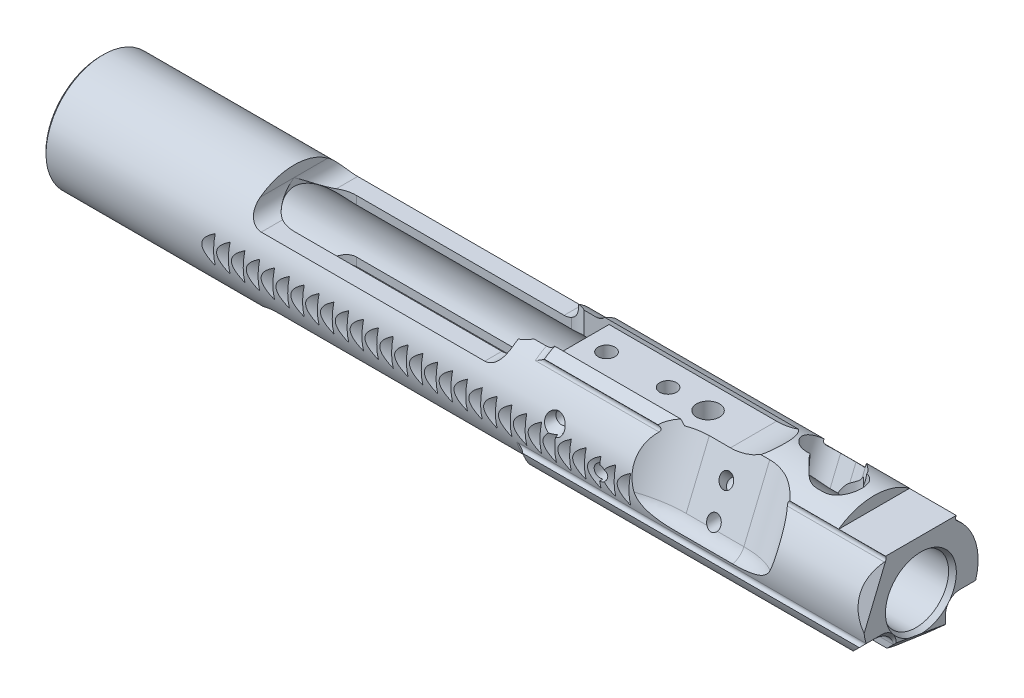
SolidWorks part; units mm, degrees
ref_plane "Front Plane" through (0, 0, 0) normal (0, 0, 1) x (1, 0, 0)
ref_plane "Top Plane" through (0, 0, 0) normal (0, 1, 0) x (1, 0, 0)
ref_plane "Right Plane" through (0, 0, 0) normal (1, 0, 0) x (0, 0, -1)
sketch "Sketch1" plane through (0, 0, 0) normal (1, 0, 0) x (0, 0, -1)
  circle A0 centre (0, 0) radius 11.7983
  dimension "D1" = 23.5966
extrude "Boss-Extrude1" add sketch "Sketch1" against normal blind 169.164
sketch "Sketch2" plane through (-169.164, 0, 0) normal (-1, 0, 0) x (0, 0, 1)
  circle A0 centre (0, 0) radius 7.9375
  dimension "D1" = 15.875
extrude "Cut-Extrude1" cut sketch "Sketch2" against normal blind 97.917
fillet "Fillet1" radius 1.5875 1 edges at (-71.247, 0, 7.9375)
sketch "Sketch3" plane through (0, 0, 0) normal (0, 0, 1) x (1, 0, 0)
  line L0 (-80.01, 6.35) -> (-126.111, 6.35)
  line L1 (-129.286, 9.525) -> (-129.286, 11.7983)
  line L2 (0, 11.7983) -> (-169.164, 11.7983) construction
  line L3 (-129.286, 11.7983) -> (-76.835, 11.7983)
  line L4 (-76.835, 11.7983) -> (-76.835, 9.525)
  line L5 (-169.164, 11.7983) -> (-169.164, -11.7983) construction
  line L6 (-169.164, -11.7983) -> (0, -11.7983) construction
  line L7 (-122.3462, -6.35) -> (-71.298, -6.35)
  line L8 (-71.298, -6.35) -> (-71.298, -11.7983)
  line L9 (-71.298, -11.7983) -> (-129.286, -11.7983)
  arc A0 (-126.111, 6.35) -> (-129.286, 9.525) centre (-126.111, 9.525) cw
  arc A1 (-80.01, 6.35) -> (-76.835, 9.525) centre (-80.01, 9.525) ccw
  arc A2 (-122.3462, -6.35) -> (-129.286, -11.7983) centre (-122.3462, -13.494) ccw
  dimension "D4" = 3.175
  dimension "D7" = 14.288
  dimension "D1" = 6.35
  dimension "D2" = 39.878
  dimension "D3" = 52.451
  dimension "D6" = 6.35
  dimension "D8" = 97.866
extrude "Cut-Extrude2" cut sketch "Sketch3" against normal mid plane 30
sketch "Sketch4" plane through (0, 6.35, 0) normal (0, 1, 0) x (1, 0, 0)
  line L0 (-136.4041, 0) -> (-71.6825, 0) construction
  line L1 (-129.286, -6.9623) -> (-129.286, 6.9623) construction
  line L3 (-122.8545, 6.4315) -> (-78.473, 6.4315)
  line L4 (-122.8545, -6.4315) -> (-78.473, -6.4315)
  line L5 (-169.164, 11.7983) -> (-169.164, -11.7983) construction
  arc A0 (-122.8545, 6.4315) -> (-122.8545, -6.4315) centre (-122.8545, 0) ccw
  arc A1 (-78.473, -6.4315) -> (-78.473, 6.4315) centre (-78.473, 0) ccw
  dimension "D1" = 12.863
  dimension "D2" = 12.863
  dimension "D3" = 90.691
extrude "Cut-Extrude3" cut sketch "Sketch4" against normal up to next and the other way up to next
sketch "Sketch5" plane through (0, -6.35, 0) normal (0, -1, 0) x (1, 0, 0)
  line L0 (-169.164, 0) -> (-116.3804, 0) construction
  line L1 (-169.164, 11.7983) -> (-169.164, -11.7983) construction
  line L2 (-129.286, 0) -> (-129.286, 4.226) construction
  line L3 (-122.8545, 6.4315) -> (-78.1436, 6.4315)
  line L4 (-78.1436, 6.4315) -> (-78.1436, -6.4315)
  line L5 (-78.1436, -6.4315) -> (-122.8545, -6.4315)
  arc A0 (-122.8545, 6.4315) -> (-122.8545, -6.4315) centre (-122.8545, 0) ccw
  spline S0 degree 3 poles (-122.3462, 9.9437) (-122.9959, 9.9437) (-123.6281, 9.8897) (-124.5504, 9.718) (-124.8481, 9.646) (-125.4159, 9.4721) (-125.6874, 9.3698) (-126.2059, 9.1303) (-126.4505, 8.9936) (-126.9004, 8.6908) (-127.1077, 8.5238) (-127.4897, 8.1561) (-127.6639, 7.9553) (-127.9739, 7.5305) (-128.1113, 7.3052) (-128.3563, 6.8285) (-128.4643, 6.5758) (-128.6514, 6.0562) (-128.7312, 5.7883) (-128.8695, 5.2369) (-128.9279, 4.9535) (-129.0282, 4.3715) (-129.0701, 4.0716) (-129.1752, 3.1611) (-129.2184, 2.5411) (-129.274, 1.2768) (-129.2861, 0.6287) (-129.2859, -0.6503) (-129.2737, -1.2858) (-129.2318, -2.233) (-129.2137, -2.5489) (-129.1671, -3.1727) (-129.1387, -3.4788) (-129.0343, -4.3794) (-128.9395, -4.9566) (-128.7322, -5.7849) (-128.6515, -6.056) (-128.4633, -6.5786) (-128.3566, -6.8279) (-128.1128, -7.3025) (-127.9758, -7.5278) (-127.665, -7.9541) (-127.4902, -8.1555) (-126.9207, -8.7042) (-126.4769, -9.004) (-125.4341, -9.4879) (-124.8667, -9.6584) (-123.9464, -9.8308) (-123.6295, -9.8735) (-122.9934, -9.9297) (-122.6716, -9.9437) (-122.3462, -9.9437) knots 0 0 0 0 0.0625 0.0625 0.09375 0.09375 0.125 0.125 0.15625 0.15625 0.1875 0.1875 0.21875 0.21875 0.25 0.25 0.28125 0.28125 0.3125 0.3125 0.34375 0.34375 0.375 0.375 0.4375 0.4375 0.5 0.5 0.5625 0.5625 0.59375 0.59375 0.625 0.625 0.6875 0.6875 0.71875 0.71875 0.75 0.75 0.78125 0.78125 0.8125 0.8125 0.875 0.875 0.9375 0.9375 0.96875 0.96875 1 1 1 1 construction
  dimension "D2" = 12.863
extrude "Cut-Extrude4" cut sketch "Sketch5" against normal up to next and the other way up to next
sketch "Sketch6" plane through (-169.164, 0, 0) normal (-1, 0, 0) x (0, 0, 1)
  line L0 (0, 0) -> (0, -11.7983) construction
  line L1 (-1.9939, -8.8159) -> (1.9939, -8.8159)
  line L2 (-1.9939, -8.8159) -> (-1.9939, -10.9859)
  line L3 (-1.9939, -13.3258) -> (1.9939, -13.3258)
  line L4 (1.9939, -10.9859) -> (1.9939, -8.8159)
  line L5 (-1.9939, -10.9859) -> (-2.9111, -11.9031)
  line L6 (-2.9111, -11.9031) -> (-2.9111, -13.3258)
  line L7 (-2.9111, -13.3258) -> (-1.9939, -13.3258)
  line L8 (1.9939, -10.9859) -> (2.9111, -11.9031)
  line L9 (2.9111, -11.9031) -> (2.9111, -13.3258)
  line L10 (2.9111, -13.3258) -> (1.9939, -13.3258)
  circle A0 centre (0, 0) radius 11.7983 construction
  point P9 (0, -8.8159)
  dimension "D1" = 8.8159
  dimension "D2" = 3.9878
  dimension "D3" = 2.17
extrude "Cut-Extrude5" cut sketch "Sketch6" against normal up to next
chamfer "Chamfer1" distance 0.508 1 edges at (-169.164, 11.7983, 0)
sketch "Sketch9" plane through (0, 0, 0) normal (0, 0, 1) x (1, 0, 0)
  line L0 (0, 0) -> (-71.247, 0) construction
  line L1 (-71.247, 6.35) -> (-71.247, -6.35) construction
  line L2 (-1.016, 6.731) -> (-29.845, 6.731)
  line L3 (-1.016, 6.731) -> (0, 7.3176)
  line L4 (0, -11.7983) -> (0, 11.7983) construction
  line L5 (-30.5049, 6.35) -> (-42.634, 6.35)
  line L6 (-30.5049, 6.35) -> (-29.845, 6.731)
  line L7 (-45.174, 6.35) -> (-46.863, 6.35)
  line L8 (-46.863, 6.35) -> (-46.863, 3.1877)
  line L9 (-46.863, 3.1877) -> (-49.6062, 3.1877)
  line L10 (-49.6062, 3.1877) -> (-49.6062, 3.7465)
  line L11 (-49.6062, 3.7465) -> (-57.4, 3.7465)
  line L12 (-57.4, 3.7465) -> (-57.4, 5.588)
  line L13 (-57.4, 5.588) -> (-71.247, 5.588)
  line L14 (-71.247, 5.588) -> (-71.247, 0)
  line L15 (0, 7.3176) -> (0, 0)
  line L16 (0, 0) -> (-71.247, 0)
  arc A0 (-42.634, 6.35) -> (-45.174, 6.35) centre (-43.904, 6.35) ccw
  dimension "D8" = 2.54
  dimension "D9" = 2.959
  dimension "D1" = 13.462
  dimension "D2" = 30
  dimension "D3" = 1.016
  dimension "D4" = 29.845
  dimension "D5" = 12.7
  dimension "D6" = 30
  dimension "D7" = 46.863
  dimension "D10" = 6.3754
  dimension "D11" = 2.7432
  dimension "D12" = 7.493
  dimension "D13" = 57.4
  dimension "D14" = 11.176
revolve "Cut-Revolve1" cut sketch "Sketch9" angle 360 about L0
sketch "Sketch12" plane through (0, 0, 0) normal (1, 0, 0) x (0, 0, -1)
  line L0 (0, 0) -> (0, 12.5603) construction
  line L1 (0, 0) -> (-7.9164, 9.7515) construction
  line L2 (0, 0) -> (-12.0179, -3.6513) construction
  arc A1 (-11.7743, -4.3733) -> (11.7743, -4.3733) centre (0, 0) ccw
  arc A2 (-11.2888, -3.4298) -> (11.2888, -3.4298) centre (0, 0) ccw
  arc A3 (-7.4361, 9.1599) -> (-7.3105, 10.2136) centre (-7.9164, 9.7515) ccw
  arc A4 (-11.7743, -4.3733) -> (-11.2888, -3.4298) centre (-12.0179, -3.6513) ccw
  circle A5 centre (0, 0) radius 11.7983 construction
  arc A6 (11.7743, -4.3733) -> (11.2888, -3.4298) centre (12.0179, -3.6513) cw
  arc A7 (7.4361, 9.1599) -> (7.3105, 10.2136) centre (7.9164, 9.7515) cw
  arc A8 (7.3105, 10.2136) -> (-7.3105, 10.2136) centre (0, 0) ccw
  arc A9 (7.4361, 9.1599) -> (-7.4361, 9.1599) centre (0, 0) ccw
  dimension "D3" = 1.524
  dimension "D4" = 12.5603
  dimension "D1" = 39.07
  dimension "D2" = 106.9
extrude "Boss-Extrude2" add sketch "Sketch12" against normal blind 72.0921
sketch "Sketch13" plane through (0, 0, 0) normal (0, 0, 1) x (1, 0, 0)
  line L0 (0, 12.5603) -> (-70.358, 12.5603) construction
  line L1 (0, 12.5603) -> (-72.0921, 12.5603) construction
  line L3 (-129.286, 11.7983) -> (-72.0921, 11.7983) construction
  line L4 (0, 0) -> (-62.44, 0) construction
  line L6 (-129.286, 9.525) -> (-129.286, 11.7983) construction
  circle A0 centre (-72.0921, 14.1525) radius 2.3542
  dimension "D1" = 70.358
revolve "Cut-Revolve2" cut sketch "Sketch13" angle 360 about L4
sketch "Sketch10" plane through (0, 0, 0) normal (0, 0, 1) x (1, 0, 0)
  line L0 (-34.925, 10.617) -> (-69.4692, 10.617)
  line L1 (-75.782, 17.653) -> (-47.625, 23.317)
  arc A0 (-75.782, 17.653) -> (-69.4692, 10.617) centre (-75.782, 11.303) ccw
  arc A1 (-34.925, 10.617) -> (-47.625, 23.317) centre (-34.925, 23.317) ccw
  dimension "D1" = 12.7
  dimension "D4" = 25.4
  dimension "D2" = 75.782
  dimension "D3" = 11.303
  dimension "D5" = 23.317
  dimension "D6" = 34.925
extrude "Cut-Extrude8" cut sketch "Sketch10" against normal mid plane 10.3124
sketch "Sketch14" plane through (0, 0, 0) normal (1, 0, 0) x (0, 0, -1)
  line L0 (-7.29, 10.1854) -> (7.29, 10.1854)
  arc A0 (7.3105, 10.2136) -> (-7.3105, 10.2136) centre (0, 0) ccw construction
  arc A1 (7.3105, 10.2136) -> (-7.3105, 10.2136) centre (0, 0) ccw
  arc A2 (-7.4361, 9.1599) -> (-7.3105, 10.2136) centre (-7.9164, 9.7515) ccw construction
  arc A3 (-7.29, 10.1854) -> (-7.3105, 10.2136) centre (-7.9164, 9.7515) ccw
  arc A4 (7.3105, 10.2136) -> (7.4361, 9.1599) centre (7.9164, 9.7515) ccw construction
  arc A5 (7.3105, 10.2136) -> (7.29, 10.1854) centre (7.9164, 9.7515) ccw
  dimension "D1" = 10.1854
extrude "Cut-Extrude9" cut sketch "Sketch14" against normal blind 9.652
sketch "Sketch15" plane through (0, 0, 0) normal (1, 0, 0) x (0, 0, -1)
  line L0 (0, 0) -> (0, -12.5603) construction
  line L1 (0, 0) -> (-7.0649, -6.9865) construction
  line L2 (-8.1505, -5.3252) -> (-10.5149, -6.8701)
  line L3 (2.858, -9.246) -> (-2.858, -9.246)
  line L4 (-5.0804, -6.9865) -> (-5.0804, -8.3254)
  line L5 (-5.0804, -8.3254) -> (-2.858, -9.246)
  line L6 (5.0804, -8.3254) -> (2.858, -9.246)
  line L7 (5.0804, -6.9865) -> (5.0804, -8.3254)
  line L8 (8.1505, -5.3252) -> (10.5149, -6.8701)
  arc A0 (-11.7743, -4.3733) -> (11.7743, -4.3733) centre (0, 0) ccw construction
  arc A1 (-5.0804, -6.9865) -> (-8.1505, -5.3252) centre (-7.0649, -6.9865) ccw
  arc A2 (-10.5149, -6.8701) -> (10.5149, -6.8701) centre (0, 0) ccw
  arc A3 (5.0804, -6.9865) -> (8.1505, -5.3252) centre (7.0649, -6.9865) cw
  point P15 (0, -9.246)
  dimension "D3" = 3.969
  dimension "D1" = 45.32
  dimension "D2" = 9.936
  dimension "D4" = 5.0804
  dimension "D5" = 2.858
  dimension "D6" = 22.5
  dimension "D7" = 9.246
extrude "Cut-Extrude10" cut sketch "Sketch15" against normal blind 71.2978
sketch "Sketch17" plane through (0, 0, 0) normal (1, 0, 0) x (0, 0, -1)
  line L0 (-2.2866, -6.35) -> (-9.9437, -6.35) construction
  line L1 (9.9437, -6.35) -> (2.2866, -6.35) construction
  line L3 (-5.0804, -8.3254) -> (-5.0804, -6.9865) construction
  line L4 (-2.858, -9.246) -> (-5.0804, -8.3254) construction
  line L5 (2.858, -9.246) -> (-2.858, -9.246) construction
  line L6 (5.0804, -8.3254) -> (2.858, -9.246) construction
  line L7 (5.0804, -6.9865) -> (5.0804, -8.3254) construction
  line L9 (-5.1853, -6.35) -> (-9.7188, -6.35)
  line L10 (9.7188, -6.35) -> (5.1853, -6.35)
  line L12 (-5.0804, -8.3254) -> (-5.0804, -6.9865)
  line L13 (-2.858, -9.246) -> (-5.0804, -8.3254)
  line L14 (2.858, -9.246) -> (-2.858, -9.246)
  line L15 (5.0804, -8.3254) -> (2.858, -9.246)
  line L16 (5.0804, -6.9865) -> (5.0804, -8.3254)
  line L17 (-8.1505, -5.3252) -> (-10.5149, -6.8701) construction
  line L18 (-9.7188, -6.35) -> (-9.9925, -6.5288)
  line L19 (9.9925, -6.5288) -> (8.1505, -5.3252) construction
  line L20 (9.9925, -6.5288) -> (9.7188, -6.35)
  arc A0 (-5.0804, -6.9865) -> (-8.1505, -5.3252) centre (-7.0649, -6.9865) ccw construction
  arc A1 (8.1505, -5.3252) -> (5.0804, -6.9865) centre (7.0649, -6.9865) ccw construction
  arc A2 (-9.9925, -6.5288) -> (9.9925, -6.5288) centre (0, 0) ccw construction
  arc A3 (-5.0804, -6.9865) -> (-5.1853, -6.35) centre (-7.0649, -6.9865) ccw
  arc A4 (5.1853, -6.35) -> (5.0804, -6.9865) centre (7.0649, -6.9865) ccw
  arc A5 (-9.9925, -6.5288) -> (9.9925, -6.5288) centre (0, 0) ccw
extrude "Cut-Extrude11" cut sketch "Sketch17" against normal blind 81.2978
sketch "Sketch18" plane through (-71.2978, 0, 0) normal (1, 0, 0) x (0, 0, -1)
  line L2 (5.1853, -6.35) -> (9.7188, -6.35)
  line L3 (9.7188, -6.35) -> (8.1505, -5.3252)
  line L4 (5.1853, -6.35) -> (9.7188, -6.35)
  line L5 (9.7188, -6.35) -> (8.1505, -5.3252)
  arc A3 (8.1505, -5.3252) -> (5.1853, -6.35) centre (7.0649, -6.9865) ccw
  arc A5 (8.1505, -5.3252) -> (5.1853, -6.35) centre (7.0649, -6.9865) ccw
  dimension "D1" = 0
ref_plane "Plane1" through (0, 0, -7.0649) normal (0, 0, 1) x (1, 0, 0)
sketch "Sketch19" plane through (0, 0, -7.0649) normal (0, 0, 1) x (1, 0, 0)
  line L0 (-71.2978, -49.6068) -> (-71.2978, -5.002) construction
  line L1 (-71.2978, -49.6068) -> (-94.0311, -11.2298) construction
  arc A0 (-71.2978, -5.002) -> (-94.0311, -11.2298) centre (-71.2978, -49.6068) ccw
  dimension "D1" = 89.2097
sweep "Cut-Sweep1" cut profiles "Sketch18" path "Sketch19"
mirror "Mirror1" about plane through (0, 0, 0) normal (0, 0, 1) of "Cut-Sweep1"
sketch "Sketch20" plane through (0, 0, 0) normal (0, 0, 1) x (1, 0, 0)
  line L0 (-72.0921, -6.35) -> (-122.3462, -6.35) construction
  line L1 (-71.298, -9.246) -> (-73.2608, -9.246)
  line L2 (-71.298, -9.246) -> (-71.298, -6.35)
  line L3 (-71.298, -6.35) -> (-73.2608, -6.35)
  line L4 (-73.2608, -9.246) -> (-73.2608, -6.35)
extrude "Cut-Extrude12" cut sketch "Sketch20" against normal up to next and the other way up to next
sketch "Sketch22" plane through (0, 0, 0) normal (0, 1, 0) x (1, 0, 0)
  line L0 (-118.1731, 0) -> (-60.3792, 0) construction
  line L1 (-71.247, 5.588) -> (-71.247, -5.588) construction
  line L2 (-71.247, 5.583) -> (-71.247, -5.583)
  line L3 (-78.4735, -6.4315) -> (-73.0446, -7.1565)
  line L4 (-78.1436, -6.4315) -> (-81.7584, -6.4315) construction
  line L5 (-78.4735, -6.4315) -> (-78.4735, 6.4315)
  line L6 (-78.4735, 6.4315) -> (-73.0446, 7.1565)
  arc A0 (-73.0446, -7.1565) -> (-71.247, -5.583) centre (-72.8345, -5.583) ccw
  arc A1 (-73.0446, 7.1565) -> (-71.247, 5.583) centre (-72.8345, 5.583) cw
  point P13 (-71.247, 0)
  point P17 (-78.4735, 0)
  dimension "D1" = 3.175
  dimension "D2" = 5.583
  dimension "D3" = 5.639
extrude "Cut-Extrude13" cut sketch "Sketch22" against normal up to surface (6.35 mm away)
sketch "Sketch24" plane through (0, 0, 0) normal (0, 0, 1) x (1, 0, 0)
  line L0 (-43.307, -9.246) -> (-71.298, -8.3254)
  line L1 (-71.298, -8.3254) -> (-71.298, -9.246)
  line L2 (-71.298, -9.246) -> (-43.307, -9.246)
  line L3 (-71.298, -9.246) -> (0, -9.246) construction
  line L4 (-71.298, -8.3254) -> (-71.298, -6.9865) construction
  dimension "D2" = 43.307
extrude "Cut-Extrude15" cut sketch "Sketch24" against normal up to next and the other way up to next
sketch "Sketch25" plane through (0, 0, 0) normal (1, 0, 0) x (0, 0, -1)
  line L0 (-11.2887, -3.43) -> (11.2887, -3.43) construction
  arc A0 (-7.4361, 9.1599) -> (-11.2888, -3.4298) centre (0, 0) ccw construction
  arc A1 (11.2888, -3.4298) -> (7.4361, 9.1599) centre (0, 0) ccw construction
  dimension "D1" = 3.43
ref_plane "Plane2" through (-1.715, -1.715, 0) normal (0.7071, 0.7071, 0) x (-0.7071, 0.7071, 0)
sketch "Sketch27" plane through (-1.715, -1.715, 0) normal (0.7071, 0.7071, 0) x (-0.7071, 0.7071, 0)
  line L0 (-2.4254, 11.2887) -> (-2.4254, -11.2887) construction
  line L1 (-4.9402, -5.0804) -> (-5.887, -5.0804) construction
  line L2 (-4.5319, -5.0804) -> (-5.7795, -5.0804)
  line L3 (-2.4254, -8.059) -> (-2.4254, -11.7743)
  line L4 (46.6582, -11.7743) -> (-3.0924, -11.7743) construction
  line L5 (-2.4254, -11.7743) -> (-6.6384, -11.7743)
  line L6 (-6.6384, -11.7743) -> (-6.6384, -5.0804)
  line L7 (0, 0) -> (-14.9346, 0) construction
  line L8 (-2.4254, 11.7743) -> (-6.6384, 11.7743)
  line L9 (-2.4254, 8.059) -> (-2.4254, 11.7743)
  line L11 (-6.6384, 11.7743) -> (-6.6384, 5.0804)
  line L12 (-4.5319, 5.0804) -> (-5.7795, -5.0804)
  line L13 (-6.6384, 5.0804) -> (-6.6384, -5.0804)
  ellipse E0 centre (-4.5319, -8.059) end of major axis (-4.5319, -5.0804) minor radius 2.1065 (-2.4254, -8.059) -> (-4.5319, -5.0804) ccw
  ellipse E1 centre (-4.5319, 8.059) end of major axis (-4.5319, 5.0804) minor radius 2.1065 (-2.4254, 8.059) -> (-4.5319, 5.0804) cw
  dimension "D1" = 8.059
  dimension "D2" = 4.213
  dimension "D3" = 7
extrude "Cut-Extrude17" cut sketch "Sketch27" against normal blind 8.3566
sketch "Sketch28" plane through (0, 0, 0) normal (1, 0, 0) x (0, 0, -1)
  line L0 (0, 0) -> (0, 9.2596) construction
  line L1 (-12.197, -2.5741) -> (-7.2124, 9.4599)
  arc A0 (-7.4361, 9.1599) -> (-7.29, 10.1854) centre (-7.9164, 9.7515) ccw construction
  dimension "D1" = 22.5
ref_plane "Plane3" through (0, 9.4599, 0) normal (0, 1, 0) x (-1, 0, 0)
sketch "Sketch31" plane through (0, 9.4599, 0) normal (0, 1, 0) x (-1, 0, 0)
  line L0 (0, 7.2124) -> (5, 12.2124)
  line L1 (5, 12.2124) -> (0, 12.2124)
  line L2 (0, 12.2124) -> (0, 7.2124)
  dimension "D1" = 45
  dimension "D2" = 5
sweep "Cut-Sweep2" cut profiles "Sketch31" path "Sketch28"
ref_plane "Plane4" through (-27.388, 0, 0) normal (1, 0, 0) x (0, 0, -1)
sketch "Sketch32" plane through (-27.388, 0, 0) normal (1, 0, 0) x (0, 0, -1)
  line L0 (-9.1211, -0.891) -> (-3.7922, 11.9742)
  line L1 (0, 0) -> (0, 9.0623) construction
  line L2 (-9.1211, -0.891) -> (-14.1082, 1.1747) construction
  line L3 (-12.0544, 0.324) -> (-13.2694, -2.6093) construction
  arc A0 (-13.2694, -2.6093) -> (-9.1211, -0.891) centre (-12.0544, 0.324) ccw
  arc A1 (7.3105, 10.2136) -> (-7.3105, 10.2136) centre (0, 0) ccw construction
  arc A2 (7.3105, 10.2136) -> (-7.3105, 10.2136) centre (0, 0) ccw construction
  dimension "D4" = 6.35
  dimension "D1" = 22.5
  dimension "D2" = 9.1211
  dimension "D3" = 0.891
ref_plane "Plane5" through (-27.388, 11.9742, 3.7922) normal (0, 0.9239, -0.3827) x (-1, 0, 0)
sketch "Sketch33" plane through (-27.388, 11.9742, 3.7922) normal (0, 0.9239, -0.3827) x (-1, 0, 0)
  line L0 (0, 0) -> (11.899, 0)
  line L1 (-8.9803, 3.7197) -> (20.8793, 3.7197)
  arc A0 (-8.9803, 3.7197) -> (0, 0) centre (0, 12.7) ccw
  arc A1 (11.899, 0) -> (20.8793, 3.7197) centre (11.899, 12.7) ccw
  dimension "D1" = 25.4
  dimension "D2" = 25.4
  dimension "D3" = 11.899
sweep "Cut-Sweep4" cut profiles "Sketch33" path "Sketch32"
fillet "Fillet2" radius 2 1 edges at (-71.298, -8.3254, 0)
sketch "Sketch34" plane through (0, 10.617, 0) normal (0, 1, 0) x (1, 0, 0)
  line L0 (0, 0) -> (-69.4692, 0) construction
  line L1 (-69.4692, 5.1562) -> (-69.4692, -5.1562) construction
  circle A0 centre (-43.9039, 0) radius 2.3749
  dimension "D1" = 4.7498
  dimension "D2" = 43.9039
extrude "Cut-Extrude18" cut sketch "Sketch34" against normal up to next
ref_plane "Plane6" through (-64.2747, 0, 0) normal (1, 0, 0) x (0, 0, -1)
sketch "Sketch35" plane through (-64.2747, 0, 0) normal (1, 0, 0) x (0, 0, -1)
  line L0 (0, 0) -> (0, 10.617) construction
  line L2 (-11.8825, 3.9692) -> (11.8825, 3.9692) construction
  line L3 (5.1562, 10.617) -> (-5.1562, 10.617) construction
  line L4 (-9.7907, 5.2011) -> (0, 5.2011)
  line L5 (-9.7907, 5.2011) -> (-11.8825, 6.4088)
  line L6 (-11.8825, 3.9692) -> (-11.8825, 6.4088)
  line L7 (0, 5.2011) -> (6.6656, 5.2011)
  line L8 (6.6656, 5.2011) -> (10.7351, 7.5506)
  line L9 (11.8825, 7.5506) -> (11.8825, 3.9692)
  line L10 (10.7351, 7.5506) -> (11.8825, 7.5506)
  line L11 (11.8825, 3.9692) -> (-11.8825, 3.9692)
  point P10 (0, 3.9692)
  dimension "D1" = 6.6478
  dimension "D2" = 2.4638
  dimension "D3" = 9.7907
  dimension "D4" = 30
  dimension "D5" = 30
  dimension "D6" = 6.6656
  dimension "D7" = 7.1628
revolve "Cut-Revolve3" cut sketch "Sketch35" angle 360 about L11
sketch "Sketch36" plane through (0, 0, 0) normal (0, 0, 1) x (1, 0, 0)
  circle A0 centre (-54.5211, 0) radius 1.4351
  circle A1 centre (-33.9344, 0) radius 1.397
  dimension "D1" = 2.8702
  dimension "D2" = 54.5211
  dimension "D3" = 2.794
  dimension "D4" = 33.9344
extrude "Cut-Extrude19" cut sketch "Sketch36" along normal up to next
ref_plane "Plane7" through (-33.9344, 0, 0) normal (1, 0, 0) x (0, 0, -1)
sketch "Sketch37" plane through (-33.9344, 0, 0) normal (1, 0, 0) x (0, 0, -1)
  line L0 (0, 0) -> (-8.0365, 0) construction
  line L1 (0, 0) -> (-7.7756, 7.7756) construction
  line L2 (-7.7756, 7.7756) -> (-6.7878, 8.7634)
  line L3 (-6.7878, 8.7634) -> (-2.0988, 4.0744)
  line L4 (-2.0988, 4.0744) -> (-3.0866, 3.0866)
  line L5 (-7.7756, 7.7756) -> (-3.0866, 3.0866)
  dimension "D1" = 45
  dimension "D2" = 2.794
revolve "Cut-Revolve4" cut sketch "Sketch37" angle 360 about L1
sketch "Sketch38" plane through (0, 0, 0) normal (0, 1, 0) x (1, 0, 0)
  line L0 (0, 0) -> (-126.9169, 0) construction
  line L1 (-136.5261, -18.8523) -> (-134.0988, -18.8523)
  line L2 (0, -18.8523) -> (-162.5946, -18.8523) construction
  line L3 (-136.5261, -18.8523) -> (-136.5261, -11.7983)
  line L4 (-134.0988, -18.8523) -> (-134.0988, -10.9148)
  line L5 (-134.0988, -10.9148) -> (-136.5261, -11.7983)
  line L6 (-133.4661, -18.8523) -> (-133.4661, -11.7983)
  line L7 (-131.0388, -10.9148) -> (-133.4661, -11.7983)
  line L8 (-131.0388, -18.8523) -> (-131.0388, -10.9148)
  line L9 (-133.4661, -18.8523) -> (-131.0388, -18.8523)
  line L10 (-130.4061, -18.8523) -> (-130.4061, -11.7983)
  line L11 (-127.9788, -10.9148) -> (-130.4061, -11.7983)
  line L12 (-127.9788, -18.8523) -> (-127.9788, -10.9148)
  line L13 (-130.4061, -18.8523) -> (-127.9788, -18.8523)
  line L14 (-127.3461, -18.8523) -> (-127.3461, -11.7983)
  line L15 (-124.9188, -10.9148) -> (-127.3461, -11.7983)
  line L16 (-124.9188, -18.8523) -> (-124.9188, -10.9148)
  line L17 (-127.3461, -18.8523) -> (-124.9188, -18.8523)
  line L18 (-124.2861, -18.8523) -> (-124.2861, -11.7983)
  line L19 (-121.8588, -10.9148) -> (-124.2861, -11.7983)
  line L20 (-121.8588, -18.8523) -> (-121.8588, -10.9148)
  line L21 (-124.2861, -18.8523) -> (-121.8588, -18.8523)
  line L22 (-121.2261, -18.8523) -> (-121.2261, -11.7983)
  line L23 (-118.7988, -10.9148) -> (-121.2261, -11.7983)
  line L24 (-118.7988, -18.8523) -> (-118.7988, -10.9148)
  line L25 (-121.2261, -18.8523) -> (-118.7988, -18.8523)
  line L26 (-118.1661, -18.8523) -> (-118.1661, -11.7983)
  line L27 (-115.7388, -10.9148) -> (-118.1661, -11.7983)
  line L28 (-115.7388, -18.8523) -> (-115.7388, -10.9148)
  line L29 (-118.1661, -18.8523) -> (-115.7388, -18.8523)
  line L30 (-115.1061, -18.8523) -> (-115.1061, -11.7983)
  line L31 (-112.6788, -10.9148) -> (-115.1061, -11.7983)
  line L32 (-112.6788, -18.8523) -> (-112.6788, -10.9148)
  line L33 (-115.1061, -18.8523) -> (-112.6788, -18.8523)
  line L34 (-112.0461, -18.8523) -> (-112.0461, -11.7983)
  line L35 (-109.6188, -10.9148) -> (-112.0461, -11.7983)
  line L36 (-109.6188, -18.8523) -> (-109.6188, -10.9148)
  line L37 (-112.0461, -18.8523) -> (-109.6188, -18.8523)
  line L38 (-108.9861, -18.8523) -> (-108.9861, -11.7983)
  line L39 (-106.5588, -10.9148) -> (-108.9861, -11.7983)
  line L40 (-106.5588, -18.8523) -> (-106.5588, -10.9148)
  line L41 (-108.9861, -18.8523) -> (-106.5588, -18.8523)
  line L42 (-105.9261, -18.8523) -> (-105.9261, -11.7983)
  line L43 (-103.4988, -10.9148) -> (-105.9261, -11.7983)
  line L44 (-103.4988, -18.8523) -> (-103.4988, -10.9148)
  line L45 (-105.9261, -18.8523) -> (-103.4988, -18.8523)
  line L46 (-102.8661, -18.8523) -> (-102.8661, -11.7983)
  line L47 (-100.4388, -10.9148) -> (-102.8661, -11.7983)
  line L48 (-100.4388, -18.8523) -> (-100.4388, -10.9148)
  line L49 (-102.8661, -18.8523) -> (-100.4388, -18.8523)
  line L50 (-99.8061, -18.8523) -> (-99.8061, -11.7983)
  line L51 (-97.3788, -10.9148) -> (-99.8061, -11.7983)
  line L52 (-97.3788, -18.8523) -> (-97.3788, -10.9148)
  line L53 (-99.8061, -18.8523) -> (-97.3788, -18.8523)
  line L54 (-96.7461, -18.8523) -> (-96.7461, -11.7983)
  line L55 (-94.3188, -10.9148) -> (-96.7461, -11.7983)
  line L56 (-94.3188, -18.8523) -> (-94.3188, -10.9148)
  line L57 (-96.7461, -18.8523) -> (-94.3188, -18.8523)
  line L58 (-93.6861, -18.8523) -> (-93.6861, -11.7983)
  line L59 (-91.2588, -10.9148) -> (-93.6861, -11.7983)
  line L60 (-91.2588, -18.8523) -> (-91.2588, -10.9148)
  line L61 (-93.6861, -18.8523) -> (-91.2588, -18.8523)
  line L62 (-90.6261, -18.8523) -> (-90.6261, -11.7983)
  line L63 (-88.1988, -10.9148) -> (-90.6261, -11.7983)
  line L64 (-88.1988, -18.8523) -> (-88.1988, -10.9148)
  line L65 (-90.6261, -18.8523) -> (-88.1988, -18.8523)
  line L66 (-87.5661, -18.8523) -> (-87.5661, -11.7983)
  line L67 (-85.1388, -10.9148) -> (-87.5661, -11.7983)
  line L68 (-85.1388, -18.8523) -> (-85.1388, -10.9148)
  line L69 (-87.5661, -18.8523) -> (-85.1388, -18.8523)
  line L70 (-84.5061, -18.8523) -> (-84.5061, -11.7983)
  line L71 (-82.0788, -10.9148) -> (-84.5061, -11.7983)
  line L72 (-82.0788, -18.8523) -> (-82.0788, -10.9148)
  line L73 (-84.5061, -18.8523) -> (-82.0788, -18.8523)
  line L74 (-81.4461, -18.8523) -> (-81.4461, -11.7983)
  line L75 (-79.0188, -10.9148) -> (-81.4461, -11.7983)
  line L76 (-79.0188, -18.8523) -> (-79.0188, -10.9148)
  line L77 (-81.4461, -18.8523) -> (-79.0188, -18.8523)
  line L78 (-78.3861, -18.8523) -> (-78.3861, -11.7983)
  line L79 (-75.9588, -10.9148) -> (-78.3861, -11.7983)
  line L80 (-75.9588, -18.8523) -> (-75.9588, -10.9148)
  line L81 (-78.3861, -18.8523) -> (-75.9588, -18.8523)
  line L82 (-75.3261, -18.8523) -> (-75.3261, -11.7983)
  line L83 (-72.8988, -10.9148) -> (-75.3261, -11.7983)
  line L84 (-72.8988, -18.8523) -> (-72.8988, -10.9148)
  line L85 (-75.3261, -18.8523) -> (-72.8988, -18.8523)
  line L86 (-72.2661, -18.8523) -> (-72.2661, -11.7983)
  line L87 (-69.8388, -10.9148) -> (-72.2661, -11.7983)
  line L88 (-69.8388, -18.8523) -> (-69.8388, -10.9148)
  line L89 (-72.2661, -18.8523) -> (-69.8388, -18.8523)
  line L90 (-69.2061, -18.8523) -> (-69.2061, -11.7983)
  line L91 (-66.7788, -10.9148) -> (-69.2061, -11.7983)
  line L92 (-66.7788, -18.8523) -> (-66.7788, -10.9148)
  line L93 (-69.2061, -18.8523) -> (-66.7788, -18.8523)
  line L94 (-66.1461, -18.8523) -> (-66.1461, -11.7983)
  line L95 (-63.7188, -10.9148) -> (-66.1461, -11.7983)
  line L96 (-63.7188, -18.8523) -> (-63.7188, -10.9148)
  line L97 (-66.1461, -18.8523) -> (-63.7188, -18.8523)
  line L98 (-63.0861, -18.8523) -> (-63.0861, -11.7983)
  line L99 (-60.6588, -10.9148) -> (-63.0861, -11.7983)
  line L100 (-60.6588, -18.8523) -> (-60.6588, -10.9148)
  line L101 (-63.0861, -18.8523) -> (-60.6588, -18.8523)
  line L102 (-60.0261, -18.8523) -> (-60.0261, -11.7983)
  line L103 (-57.5988, -10.9148) -> (-60.0261, -11.7983)
  line L104 (-57.5988, -18.8523) -> (-57.5988, -10.9148)
  line L105 (-60.0261, -18.8523) -> (-57.5988, -18.8523)
  line L106 (-56.9661, -18.8523) -> (-56.9661, -11.7983)
  line L107 (-54.5388, -10.9148) -> (-56.9661, -11.7983)
  line L108 (-54.5388, -18.8523) -> (-54.5388, -10.9148)
  line L109 (-56.9661, -18.8523) -> (-54.5388, -18.8523)
  line L110 (-53.9061, -18.8523) -> (-53.9061, -11.7983)
  line L111 (-51.4788, -10.9148) -> (-53.9061, -11.7983)
  line L112 (-51.4788, -18.8523) -> (-51.4788, -10.9148)
  line L113 (-53.9061, -18.8523) -> (-51.4788, -18.8523)
  line L114 (-50.8461, -18.8523) -> (-50.8461, -11.7983)
  line L115 (-48.4188, -10.9148) -> (-50.8461, -11.7983)
  line L116 (-48.4188, -18.8523) -> (-48.4188, -10.9148)
  line L117 (-50.8461, -18.8523) -> (-48.4188, -18.8523)
  dimension "D1" = 18.8523
  dimension "D2" = 136.5261
  dimension "D3" = 7.9375
  dimension "D4" = 70
  dimension "D5" = 2.4273
  dimension "D6" = 29
revolve "Cut-Revolve5" cut sketch "Sketch38" angle 360 about L2
ref_plane "Plane8" through (0, 12.5603, 0) normal (0, 1, 0) x (-1, 0, 0)
sketch "Sketch39" plane through (0, 12.5603, 0) normal (0, 1, 0) x (-1, 0, 0)
  line L0 (16.1608, 0) -> (17.4308, 0) construction
  line L1 (17.4308, 0) -> (20.2371, -2.8063) construction
  line L2 (16.1608, 3.9688) -> (17.4308, 3.9688)
  line L3 (20.2371, -2.8063) -> (17.4308, -5.6126) construction
  line L4 (17.4308, -5.6126) -> (15.7673, -3.9492)
  line L5 (20.2371, -2.8063) -> (23.0434, 0) construction
  line L6 (23.0434, 0) -> (20.2371, 2.8063)
  arc A0 (16.1608, 3.9688) -> (15.7673, -3.9492) centre (16.1608, 0) ccw
  arc A1 (20.2371, 2.8063) -> (17.4308, 3.9688) centre (17.4308, 0) ccw
  arc A2 (17.4308, -5.6126) -> (23.0434, 0) centre (20.2371, -2.8063) ccw
  arc A5 (20.2241, -2.8193) -> (20.2501, -2.7933) centre (17.4308, 0) ccw
  dimension "D1" = 7.9375
  dimension "D4" = 3.9688
  dimension "D7" = 3.9688
  dimension "D2" = 16.1608
  dimension "D3" = 1.27
  dimension "D5" = 45
  dimension "D6" = 2.8063
extrude "Cut-Extrude20" cut sketch "Sketch39" against normal blind 12.5603
ref_plane "Plane9" through (0, 11.6042, -4.8066) normal (0, 0.9239, -0.3827) x (-1, 0, 0)
sketch "Sketch40" plane through (0, 11.6042, -4.8066) normal (0, 0.9239, -0.3827) x (-1, 0, 0)
  line L0 (24.4793, 0) -> (21.3043, 0) construction
  line L1 (21.3043, 0) -> (18.498, 2.8063) construction
  line L2 (24.4793, -3.9688) -> (21.3043, -3.9687)
  line L3 (18.498, 2.8063) -> (15.6917, 0) construction
  line L4 (18.498, 2.8063) -> (21.3043, 5.6126) construction
  line L5 (21.3043, 5.6126) -> (22.9482, 3.9688)
  line L6 (15.6917, 0) -> (18.498, -2.8063)
  line L7 (24.4793, 3.9688) -> (22.9482, 3.9688)
  arc A0 (24.4793, -3.9688) -> (24.4793, 3.9688) centre (24.4793, 0) ccw
  arc A3 (18.498, -2.8063) -> (21.3043, -3.9687) centre (21.3043, 0) ccw
  arc A4 (18.511, 2.8193) -> (18.485, 2.7933) centre (21.3043, 0) ccw
  arc A5 (21.3043, 5.6126) -> (15.6917, 0) centre (18.498, 2.8063) ccw
  dimension "D1" = 7.9375
  dimension "D2" = 24.4793
  dimension "D3" = 45
  dimension "D4" = 3.175
  dimension "D5" = 2.8063
extrude "Cut-Extrude21" cut sketch "Sketch40" against normal blind 12.5603
hole_wizard "#8-32 Tapped Hole1" positions "Sketch42" profile "Sketch41" tap size "#8-32" standard "Ansi Inch"
sketch "Sketch42" plane through (0, 10.617, 0) normal (0, 1, 0) x (-1, 0, 0)
  point P0 (64.841, 0)
  point P1 (52.141, 0)
  dimension "D1" = 12.7
  dimension "D2" = 52.141
sketch "Sketch41" plane through (-64.841, 10.617, 0) normal (1, 0, 0) x (0, 0, 1)
  line L0 (0, 0) -> (0, 5.029)
  line L1 (0, 5.029) -> (1.7272, 5.029)
  line L2 (1.7272, 5.029) -> (1.7272, 0)
  line L5 (1.7272, 0) -> (0, 0)
  line L11 (0, -6.35) -> (0, 107.95) construction
  dimension "Thru Tap Drill Dia." = 3.4544
  dimension "Thru Tap Drill Depth" = 5.029
